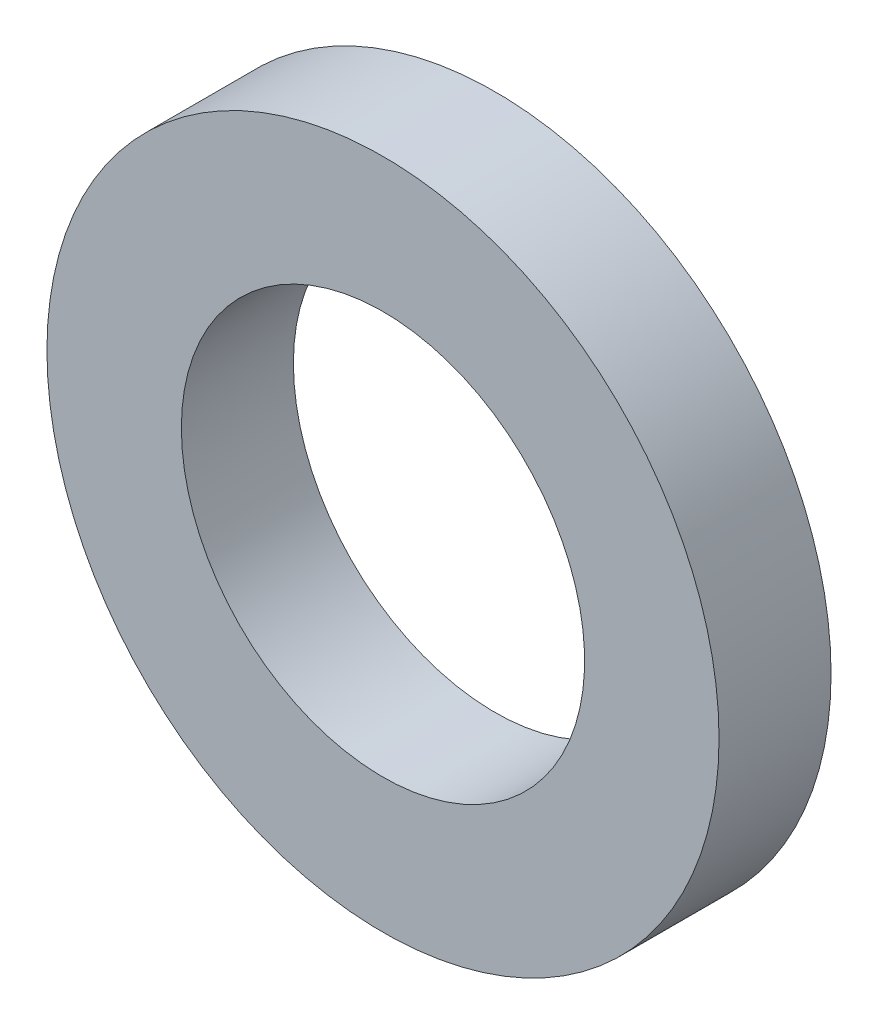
SolidWorks part; units mm, degrees
ref_plane "Front Plane" through (0, 0, 0) normal (0, 0, 1) x (1, 0, 0)
ref_plane "Top Plane" through (0, 0, 0) normal (0, 1, 0) x (1, 0, 0)
ref_plane "Right Plane" through (0, 0, 0) normal (1, 0, 0) x (0, 0, -1)
sketch "Sketch1" plane through (0, 0, 0) normal (0, 0, 1) x (1, 0, 0)
  circle A0 centre (0, 0) radius 19.05
  dimension "D1" = 38.1
extrude "Base-Extrude" add sketch "Sketch1" along normal blind 6.35
sketch "Sketch3" plane through (0, 0, 0) normal (0, 0, -1) x (-1, 0, 0)
  circle A0 centre (0, 0) radius 11.43
  circle A1 centre (0, 0) radius 19.05 construction
  dimension "D1" = 22.86
extrude "Cut-Extrude1" cut sketch "Sketch3" against normal through all
